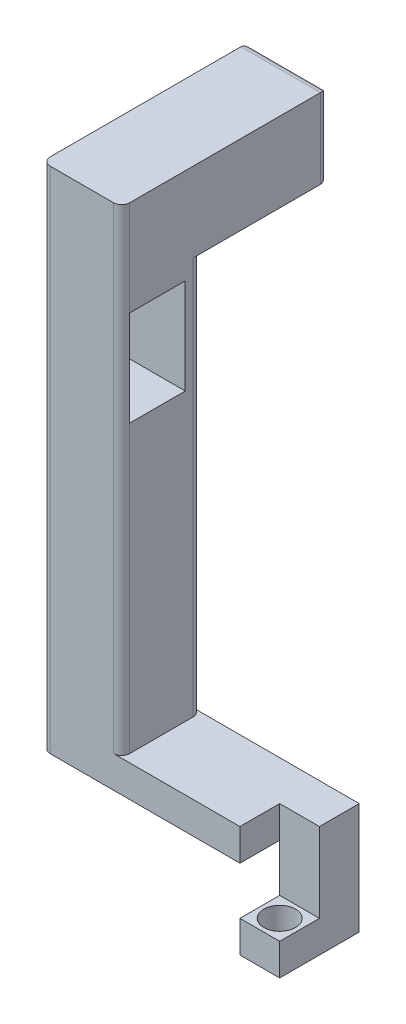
SolidWorks part; units mm, degrees
ref_plane "Front Plane" through (0, 0, 0) normal (0, 0, 1) x (1, 0, 0)
ref_plane "Top Plane" through (0, 0, 0) normal (0, 1, 0) x (1, 0, 0)
ref_plane "Right Plane" through (0, 0, 0) normal (1, 0, 0) x (0, 0, -1)
sketch "Sketch1" plane through (0, 0, 0) normal (0, 1, 0) x (1, 0, 0)
  line L1 (-7.47, 2.5) -> (7.47, 2.5)
  line L2 (-7.47, 2.5) -> (-7.47, -2.5)
  line L3 (-7.47, -2.5) -> (7.47, -2.5)
  line L4 (7.47, 2.5) -> (7.47, -2.5)
  line L5 (-7.47, 2.5) -> (7.47, -2.5) construction
  line L6 (-7.47, -2.5) -> (7.47, 2.5) construction
  point P0 (0, 0)
  dimension "D1" = 5
  dimension "D2" = 14.94
extrude "Boss-Extrude1" add sketch "Sketch1" along normal blind 2
sketch "Sketch3" plane through (0, 2, 0) normal (0, 1, 0) x (1, 0, 0)
  line L1 (-7.47, 2.5) -> (-2.47, 2.5)
  line L2 (-7.47, 2.5) -> (-7.47, -2.5)
  line L3 (-7.47, -2.5) -> (-2.47, -2.5)
  line L4 (-2.47, 2.5) -> (-2.47, -2.5)
  line L5 (-7.47, 2.5) -> (-2.47, -2.5) construction
  line L6 (7.47, -2.5) -> (7.47, 2.5)
  line L7 (7.47, 2.5) -> (-7.47, 2.5)
  line L8 (-7.47, 2.5) -> (-7.47, -2.5)
  line L9 (-7.47, -2.5) -> (7.47, -2.5)
  line L12 (7.47, -2.5) -> (7.47, 2.5)
  line L13 (7.47, 2.5) -> (-7.47, 2.5)
  line L14 (-7.47, 2.5) -> (-7.47, -2.5)
  line L15 (-7.47, -2.5) -> (7.47, -2.5)
  line L18 (-7.47, -2.5) -> (-2.47, 2.5) construction
  point P6 (-4.97, 0)
  dimension "D2" = 5
  dimension "D1" = 0
extrude "Boss-Extrude3" add sketch "Sketch3" along normal blind 30 contours L4 M9 M10 M11
sketch "Sketch4" plane through (0, 0, -2.5) normal (0, 0, -1) x (-1, 0, 0)
  line L1 (2.47, 32) -> (7.47, 32)
  line L2 (2.47, 32) -> (2.47, 27)
  line L3 (2.47, 27) -> (7.47, 27)
  line L4 (7.47, 32) -> (7.47, 27)
  line L5 (2.47, 32) -> (7.47, 27) construction
  line L6 (-7.47, 0) -> (7.47, 0)
  line L7 (7.47, 0) -> (7.47, 32)
  line L8 (7.47, 32) -> (2.47, 32)
  line L9 (2.47, 32) -> (2.47, 2)
  line L10 (2.47, 2) -> (-7.47, 2)
  line L11 (-7.47, 2) -> (-7.47, 0)
  line L12 (-7.47, 0) -> (7.47, 0)
  line L13 (7.47, 0) -> (7.47, 32)
  line L14 (7.47, 32) -> (2.47, 32)
  line L15 (2.47, 32) -> (2.47, 2)
  line L16 (2.47, 2) -> (-7.47, 2)
  line L17 (-7.47, 2) -> (-7.47, 0)
  line L18 (2.47, 27) -> (7.47, 32) construction
  point P6 (4.97, 29.5)
  dimension "D2" = 5
  dimension "D1" = 0
extrude "Boss-Extrude4" add sketch "Sketch4" along normal blind 8 contours L3 M10 M8 M9
fillet "Fillet1" radius 0.5 8 edges at (-4.97, 27, -10.5) (-4.97, 32, -10.5) (-2.47, 29.5, -10.5) (-7.47, 29.5, -10.5) (-7.47, 16, 2.5) (-7.47, 13.5, -2.5) (-2.47, 14.5, -2.5) (-2.47, 17, 2.5)
sketch "Sketch7" plane through (-7.47, 0, 0) normal (-1, 0, 0) x (0, 0, 1)
  line L1 (-1.5, 26) -> (2, 26)
  line L2 (-1.5, 26) -> (-1.5, 20)
  line L3 (-1.5, 20) -> (2, 20)
  line L4 (2, 26) -> (2, 20)
  line L5 (-1.5, 26) -> (2, 20) construction
  line L6 (2, 32) -> (-10, 32)
  line L7 (-10, 32) -> (-10, 27)
  line L8 (-10, 27) -> (-2, 27)
  line L9 (-2, 27) -> (-2, 0)
  line L10 (-2, 0) -> (2, 0)
  line L11 (2, 0) -> (2, 32)
  line L12 (2, 32) -> (-10, 32)
  line L13 (-10, 32) -> (-10, 27)
  line L14 (-10, 27) -> (-2, 27)
  line L15 (-2, 27) -> (-2, 0)
  line L16 (-2, 0) -> (2, 0)
  line L17 (2, 0) -> (2, 32)
  line L18 (-1.5, 20) -> (2, 26) construction
  point P2 (0.25, 23)
  dimension "D2" = 6
  dimension "D3" = 6
  dimension "D4" = 3.5
  dimension "D1" = 0
extrude "Cut-Extrude3" cut sketch "Sketch7" against normal blind 8 contours L2 L3 L1 M15
sketch "Sketch10" plane through (0, 0, 0) normal (0, -1, 0) x (1, 0, 0)
  line L1 (7.47, -2.5) -> (4.97, -2.5)
  line L2 (7.47, -2.5) -> (7.47, 2.5)
  line L3 (7.47, 2.5) -> (4.97, 2.5)
  line L4 (7.47, 2.5) -> (-6.97, 2.5)
  line L5 (-7.47, 2) -> (-7.47, -2)
  line L6 (-6.97, -2.5) -> (7.47, -2.5)
  line L7 (7.47, -2.5) -> (7.47, 2.5)
  line L8 (7.47, 2.5) -> (-6.97, 2.5)
  line L9 (-7.47, 2) -> (-7.47, -2)
  line L10 (-6.97, -2.5) -> (7.47, -2.5)
  line L11 (7.47, -2.5) -> (7.47, 2.5)
  line L12 (4.97, -2.5) -> (4.97, 2.5)
  line L13 (7.47, -2.5) -> (4.97, 2.5) construction
  line L14 (7.47, 2.5) -> (4.97, -2.5) construction
  arc A2 (-6.97, 2.5) -> (-7.47, 2) centre (-6.97, 2) ccw
  arc A3 (-7.47, -2) -> (-6.97, -2.5) centre (-6.97, -2) ccw
  arc A4 (-6.97, 2.5) -> (-7.47, 2) centre (-6.97, 2) ccw
  arc A5 (-7.47, -2) -> (-6.97, -2.5) centre (-6.97, -2) ccw
  point P8 (6.22, 0)
  dimension "D2" = 2.5
  dimension "D1" = 0
extrude "Boss-Extrude5" add sketch "Sketch10" along normal blind 5 contours L12 M12 M13 M8
sketch "Sketch11" plane through (7.47, 0, 0) normal (1, 0, 0) x (0, 0, -1)
  line L1 (-2.5, 2) -> (0, 2)
  line L2 (-2.5, 2) -> (-2.5, -3)
  line L3 (-2.5, -3) -> (0, -3)
  line L4 (-2.5, 2) -> (-2.5, -5)
  line L5 (-2.5, -5) -> (2.5, -5)
  line L6 (2.5, -5) -> (2.5, 2)
  line L7 (2.5, 2) -> (-2.5, 2)
  line L8 (-2.5, 2) -> (-2.5, -5)
  line L9 (-2.5, -5) -> (2.5, -5)
  line L10 (2.5, -5) -> (2.5, 2)
  line L11 (2.5, 2) -> (-2.5, 2)
  line L12 (0, 2) -> (0, -3)
  line L13 (-2.5, 2) -> (0, -3) construction
  line L14 (-2.5, -3) -> (0, 2) construction
  point P7 (-1.25, -0.5)
  dimension "D2" = 5
  dimension "D3" = 2.5
  dimension "D1" = 0
extrude "Cut-Extrude4" cut sketch "Sketch11" against normal blind 2.5 contours L12 L3 M12 M9
sketch "Sketch12" plane through (0, -3, 0) normal (0, 1, 0) x (1, 0, 0)
  line L0 (6.22, 0) -> (6.22, -2.5) construction
  line L4 (7.47, -2.5) -> (7.47, 0)
  line L5 (7.47, 0) -> (4.97, 0)
  line L6 (4.97, 0) -> (4.97, -2.5)
  line L7 (4.97, -2.5) -> (7.47, -2.5)
  line L8 (7.47, -2.5) -> (7.47, 0)
  line L9 (7.47, 0) -> (4.97, 0)
  line L10 (4.97, 0) -> (4.97, -2.5)
  line L11 (4.97, -2.5) -> (7.47, -2.5)
  circle A0 centre (6.22, -1.25) radius 1
  dimension "D1" = 0
extrude "Cut-Extrude5" cut sketch "Sketch12" against normal blind 2.5 contours A0 L0 | L0 A0
